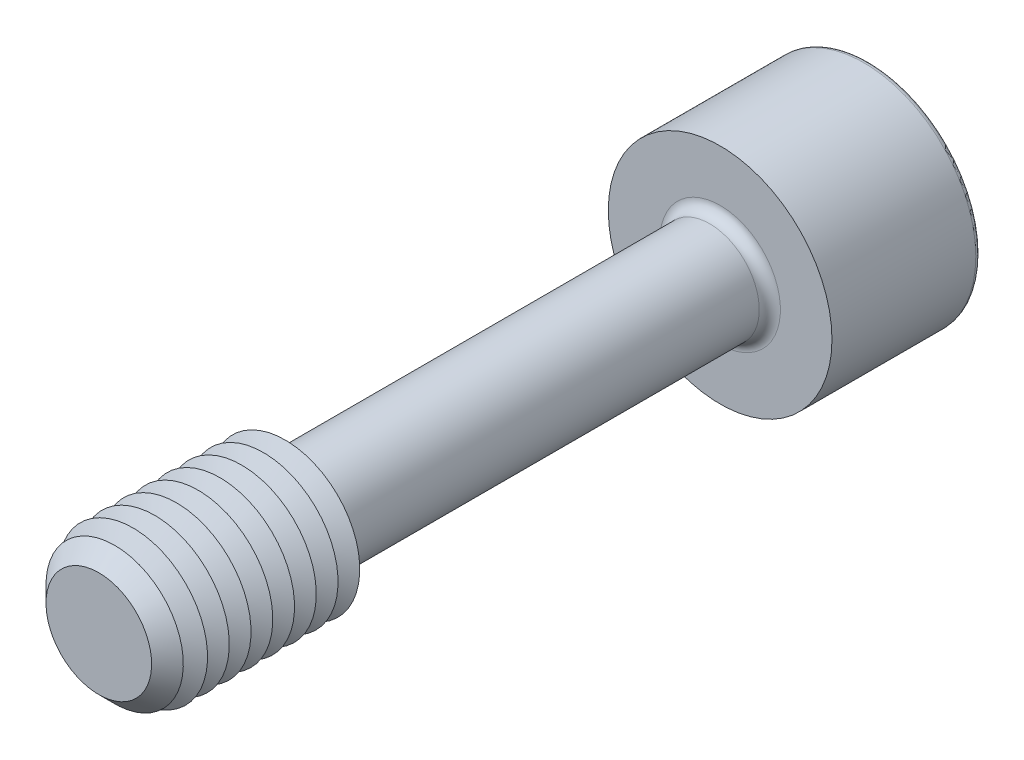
SolidWorks part; units mm, degrees
ref_plane "Front Plane" through (0, 0, 0) normal (0, 0, 1) x (1, 0, 0)
ref_plane "Top Plane" through (0, 0, 0) normal (0, 1, 0) x (1, 0, 0)
ref_plane "Right Plane" through (0, 0, 0) normal (1, 0, 0) x (0, 0, -1)
sketch "Sketch1" plane through (0, 0, 0) normal (0, 0, 1) x (1, 0, 0)
  circle A0 centre (0, 0) radius 4
  dimension "D1" = 8
extrude "Extrude1" add sketch "Sketch1" along normal mid plane 50
sketch "Sketch2" plane through (0, 0, 0) normal (1, 0, 0) x (0, 0, -1)
  line L0 (-25, 0) -> (-25, 6)
  line L1 (-25, 4) -> (-25, -4) construction
  line L2 (-25, 6) -> (-10, 6)
  line L3 (-10, 6) -> (-8.8453, 4)
  line L4 (25, 4) -> (-25, 4) construction
  line L5 (-8.8453, 4) -> (-8.8453, 0)
  line L6 (-8.8453, 0) -> (-25, 0)
  dimension "D1" = 6
  dimension "D2" = 120
  dimension "D3" = 15
revolve "Revolve1" add sketch "Sketch2" angle 360 about L6
chamfer "Chamfer1" distance 1.75 angle 45 1 edges at (0, 6, 25)
sketch "Sketch3" plane through (0, 0, -25) normal (0, 0, -1) x (-1, 0, 0)
  circle A0 centre (0, 0) radius 9
  dimension "D1" = 18
extrude "Extrude2" add sketch "Sketch3" along normal blind 12
sketch "Sketch4" plane through (-13.7, 0, -37) normal (0, 0, 1) x (1, 0, 0)
  line L2 (10.8132, -5) -> (16.5868, -5)
  line L3 (16.5868, -5) -> (19.4735, 0)
  line L4 (19.4735, 0) -> (16.5868, 5)
  line L6 (16.5868, 5) -> (10.8132, 5)
  line L7 (10.8132, 5) -> (7.9265, 0)
  line L8 (7.9265, 0) -> (10.8132, -5)
  circle A0 centre (13.7, 0) radius 5 construction
  dimension "D1" = 10
extrude "Extrude3" cut sketch "Sketch4" along normal blind 10
fillet "Fillet1" radius 0.85 1 edges at (-4, 0, -25)
fillet "Fillet2" radius 0.425 1 edges at (-9, 0, -37)
sketch "Sketch5" plane through (0, 0, 0) normal (1, 0, 0) x (0, 0, -1)
  line L0 (27, 0) -> (27, -5)
  line L1 (27, -5) -> (24.1132, 0)
  line L2 (24.1132, 0) -> (27, 0)
  dimension "D1" = 30
revolve "Cut-Revolve1" cut sketch "Sketch5" angle 360 about L2
sketch "Sketch6" plane through (0, 0, 0) normal (1, 0, 0) x (0, 0, -1)
  line L0 (1.332, 0) -> (-13.289, 0) construction
sketch "Sketch7" plane through (0, 0, 0) normal (1, 0, 0) x (0, 0, -1)
  line L0 (-10, 6) -> (-10.875, 4.4845)
  line L1 (-10.875, 4.4845) -> (-11.75, 6)
  line L2 (-10, 6) -> (-23.25, 6) construction
  line L3 (-11.75, 6) -> (-10, 6)
  dimension "D1" = 1.75
revolve "Cut-Revolve2" cut sketch "Sketch7" angle 360 about L0
pattern_linear "LPattern1" count 8 spacing 1.75 along (0, 0, 1) of "Cut-Revolve2"
